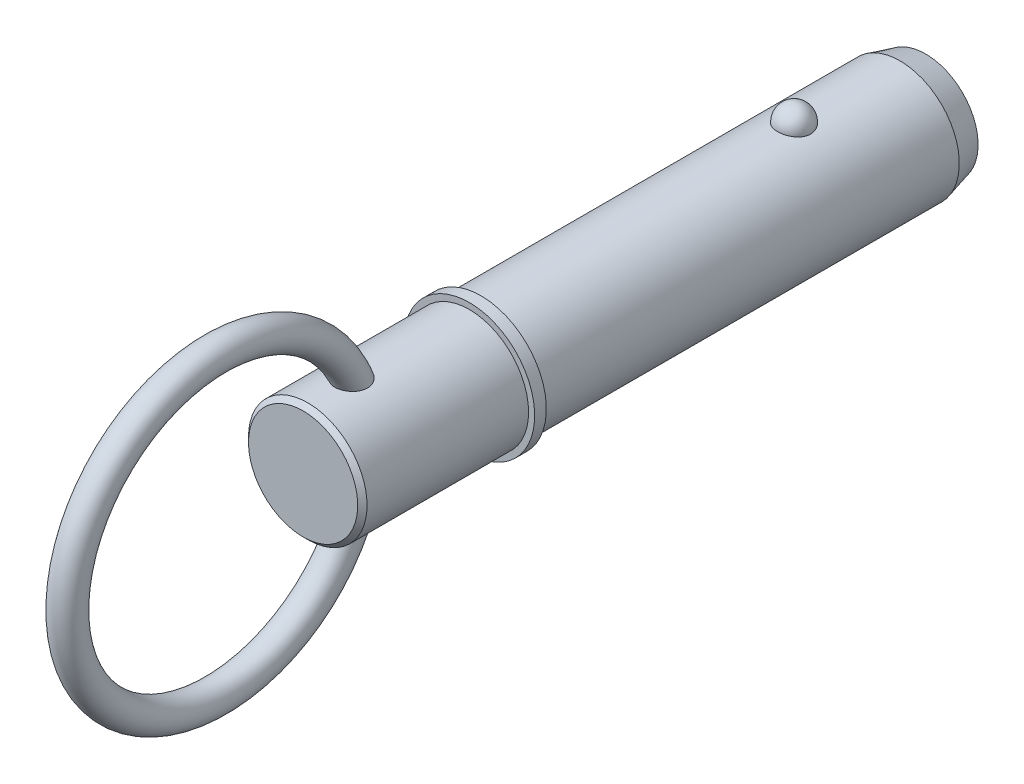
SolidWorks part; units mm, degrees
ref_plane "Front Plane" through (0, 0, 0) normal (0, 0, 1) x (1, 0, 0)
ref_plane "Top Plane" through (0, 0, 0) normal (0, 1, 0) x (1, 0, 0)
ref_plane "Right Plane" through (0, 0, 0) normal (1, 0, 0) x (0, 0, -1)
sketch "Sketch2" plane through (0, 0, 0) normal (0, 0, 1) x (1, 0, 0)
  circle A0 centre (0, 0) radius 12.7
  point P3 (0, 12.7)
  dimension "D1" = 25.4
extrude "Boss-Extrude1" add sketch "Sketch2" along normal blind 63.5
sketch "Sketch3" plane through (0, 0, 0) normal (0, 0, -1) x (-1, 0, 0)
  circle A0 centre (0, 0) radius 12.7
  dimension "D1" = 25.4
extrude "Boss-Extrude2" add sketch "Sketch3" along normal blind 31.75
chamfer "Chamfer1" distance 5.5 angle 15 1 edges at (-12.7, 0, -31.75)
sketch "Sketch18" plane through (0, 0, 0) normal (1, 0, 0) x (0, 0, -1)
  line L0 (26.25, 12.7) -> (-63.5, 12.7) construction
  line L1 (3.56, 16.26) -> (3.56, 9.14)
  line L2 (-63.5, -12.7) -> (26.25, -12.7) construction
  arc A0 (3.56, 16.26) -> (3.56, 9.14) centre (3.56, 12.7) ccw
  point P4 (0, 12.7)
  dimension "D1" = 28.96
revolve "Revolve1" add sketch "Sketch18" angle 360 about L1
sketch "Sketch19" plane through (0, 0, 0) normal (1, 0, 0) x (0, 0, -1)
  line L0 (-33.7288, 0) -> (-46.4542, 0) construction
sketch "Sketch20" plane through (0, 0, 0) normal (1, 0, 0) x (0, 0, -1)
  line L0 (-63.5, 0) -> (-63.5, 14)
  line L1 (-63.5, 12.7) -> (-63.5, -12.7) construction
  line L2 (-63.5, 14) -> (-66, 14)
  line L3 (-66, 14) -> (-66, 0)
  line L4 (-33.7288, 0) -> (-46.4542, 0) construction
  line L5 (-66, 0) -> (-63.5, 0)
  dimension "D1" = 14
  dimension "D2" = 2.5
revolve "Revolve2" add sketch "Sketch20" angle 360 about L0
sketch "Sketch21" plane through (0, 0, 63.5) normal (0, 0, -1) x (-1, 0, 0)
  circle A0 centre (0, 0) radius 12.7
  dimension "D1" = 25.4
extrude "Boss-Extrude3" add sketch "Sketch21" against normal blind 38.1
chamfer "Chamfer2" distance 1 angle 45 1 edges at (-12.7, 0, 101.6)
sketch "Sketch23" plane through (0, 0, 0) normal (1, 0, 0) x (0, 0, -1)
  line L0 (-101.6, 11.7) -> (-101.6, -11.7) construction
  circle A0 centre (-120.35, 0) radius 31.75
  point P2 (-88.6, 0)
  dimension "D1" = 63.5
  dimension "D2" = 13
sketch "Sketch24" plane through (0, 0, 0) normal (0, 1, 0) x (1, 0, 0)
  circle A0 centre (0, -88.6) radius 3.25
  dimension "D1" = 6.5
sweep "Sweep1" add profiles "Sketch24" path "Sketch23"
